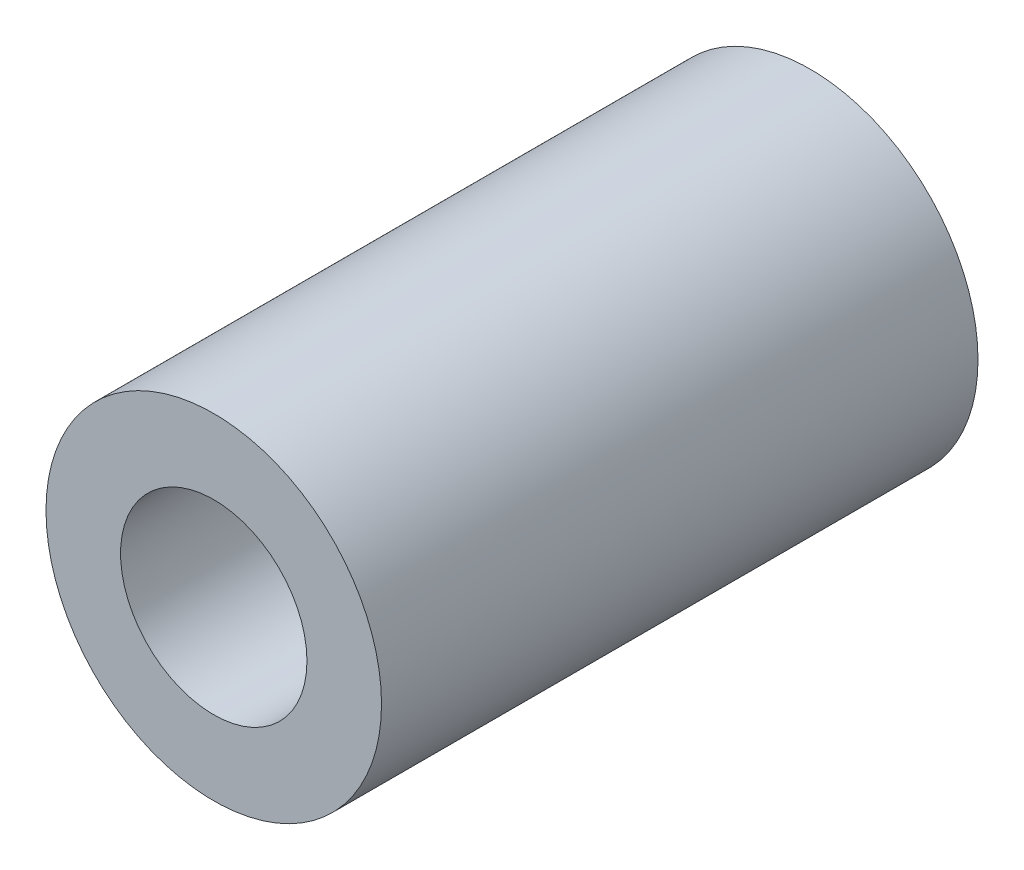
SolidWorks part; units mm, degrees
ref_plane "Plano frontal" through (0, 0, 0) normal (0, 0, 1) x (1, 0, 0)
ref_plane "Plano superior" through (0, 0, 0) normal (0, 1, 0) x (1, 0, 0)
ref_plane "Plano direito" through (0, 0, 0) normal (1, 0, 0) x (0, 0, -1)
sketch "Esboço1" plane through (0, 0, 0) normal (0, 0, 1) x (1, 0, 0)
  circle A0 centre (0, 0) radius 7.5
  circle A1 centre (0, 0) radius 13.5
  dimension "D1" = 15
  dimension "D2" = 27
extrude "Ressalto-extrusão1" add sketch "Esboço1" along normal blind 48
